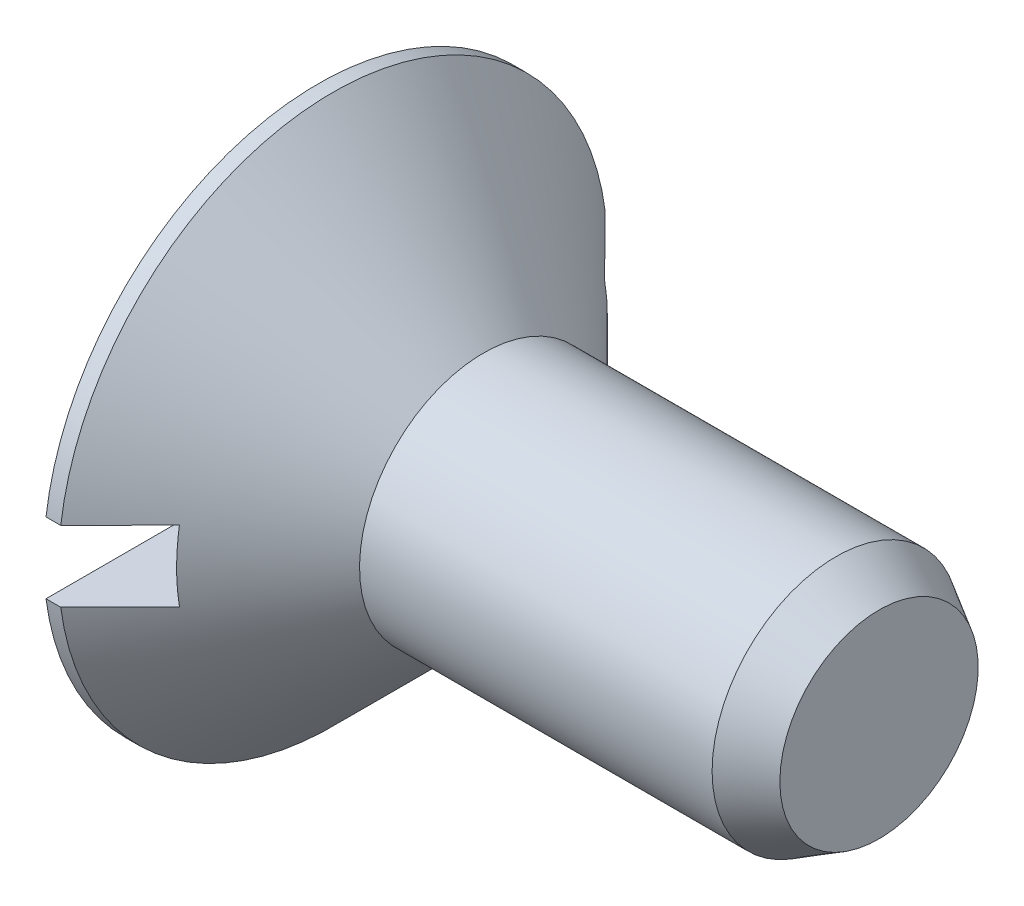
SolidWorks part; units mm, degrees
ref_plane "Front" through (0, 0, 0) normal (0, 0, 1) x (1, 0, 0)
ref_plane "Top" through (0, 0, 0) normal (0, 1, 0) x (1, 0, 0)
ref_plane "Right" through (0, 0, 0) normal (1, 0, 0) x (0, 0, -1)
sketch "Sketch1" plane through (0, 0, 0) normal (0, 0, 1) x (1, 0, 0)
  line L0 (0, 4.65) -> (0.25, 4.65)
  line L1 (0.25, 4.65) -> (2.8, 2.1)
  line L2 (2.8, 2.1) -> (9.5, 2.1)
  line L3 (9.5, 2.1) -> (9.5, 0)
  line L4 (9.5, 0) -> (0, 0)
  line L5 (0, 0) -> (0, 4.65)
  line L6 (6.6207, 0) -> (-0.9387, 0) construction
  dimension "D1" = 45
  dimension "d" = 4.2
  dimension "dK" = 9.3
  dimension "k" = 2.8
  dimension "l" = 9.5
revolve "Revolve1" add sketch "Sketch1" angle 360 about L6
sketch "Sketch2" plane through (0, 0, 0) normal (0, 0, 1) x (1, 0, 0)
  line L0 (0, 4.65) -> (0, -4.65) construction
  line L1 (0, 0.6) -> (1.25, 0.6)
  line L2 (0, 0.6) -> (0, -0.6)
  line L3 (0, -0.6) -> (1.25, -0.6)
  line L4 (1.25, 0.6) -> (1.25, -0.6)
  dimension "n" = 1.2
  dimension "t" = 1.25
extrude "Cut-Extrude1" cut sketch "Sketch2" against normal through all and the other way through all
chamfer "Chamfer1" distance 0.42 angle 60 1 edges at (9.5, 0, -2.1)
sketch "Sketch4" plane through (0, 0, 0) normal (0, 0, 1) x (1, 0, 0)
  line L0 (3.2136, 1.9) -> (2.9636, 1.9)
  line L1 (2.9636, 1.9) -> (2.8481, 2.1)
  line L2 (3.2136, 1.9) -> (3.329, 2.1)
  line L3 (2.8481, 2.1) -> (2.8481, 2.35)
  line L4 (3.329, 2.1) -> (3.329, 2.35)
  line L5 (2.8481, 2.35) -> (3.329, 2.35)
  line L6 (3.0886, 1.9) -> (3.0886, 0) construction
  line L7 (0, 0) -> (7.3035, 0) construction
  line L9 (8.7725, 2.1) -> (2.8, 2.1) construction
  line L12 (2.8, 2.1) -> (2.8, -2.1) construction
  dimension "D2" = 60
  dimension "D3" = 0.25
  dimension "threadstart" = 0.2886
  dimension "minordia" = 3.8
  dimension "advance" = 0.4809
revolve "ThreadSchematic" [suppressed] cut sketch "Sketch4" angle 360 about L7
pattern_linear "ThdSchPat" [suppressed] count 14 spacing 0.4809 along (-1, 0, 0)
sketch "Sketch3" plane through (0, 0, 0) normal (0, 0, 1) x (1, 0, 0)
  line L0 (2.8, 2.1) -> (9.5, 2.1) construction
  line L2 (7.5, 2.1) -> (8, 2.1) construction
  line L3 (9.5, 2.1) -> (9.5, 0) construction
  line L4 (8, 2.1) -> (9.5, 0)
  line L5 (2.9, 0) -> (5.4301, 0) construction
  line L6 (9.5, 0) -> (9.7, 0)
  line L7 (9.7, 0) -> (9.7, 2.1)
  line L8 (9.7, 2.1) -> (9.5, 2.1)
  line L9 (8, 2.1) -> (9.5, 2.1)
  dimension "D1" = 0.5
  dimension "y" = 2
  dimension "D2" = 0.2
revolve "EndCone" [suppressed] cut sketch "Sketch3" angle 360 about L5
equation "\"minordia@sketch4\" = \"D2@ThreadCosmetic\""
equation "\"D1@Chamfer1\" = \"d@Sketch1\" / 10"
equation "\"D1@Sketch3\" = \"y@Sketch3\" / 4"
equation "\"threadstart@Sketch4\" = \"advance@Sketch4\"*0.6"
equation "\"D1@ThdSchPat\" = int(((\"l@Sketch1\"-\"k@Sketch1\")/\"advance@Sketch4\") + 0.999)"
equation "\"D3@ThdSchPat\" =\"advance@Sketch4\""
